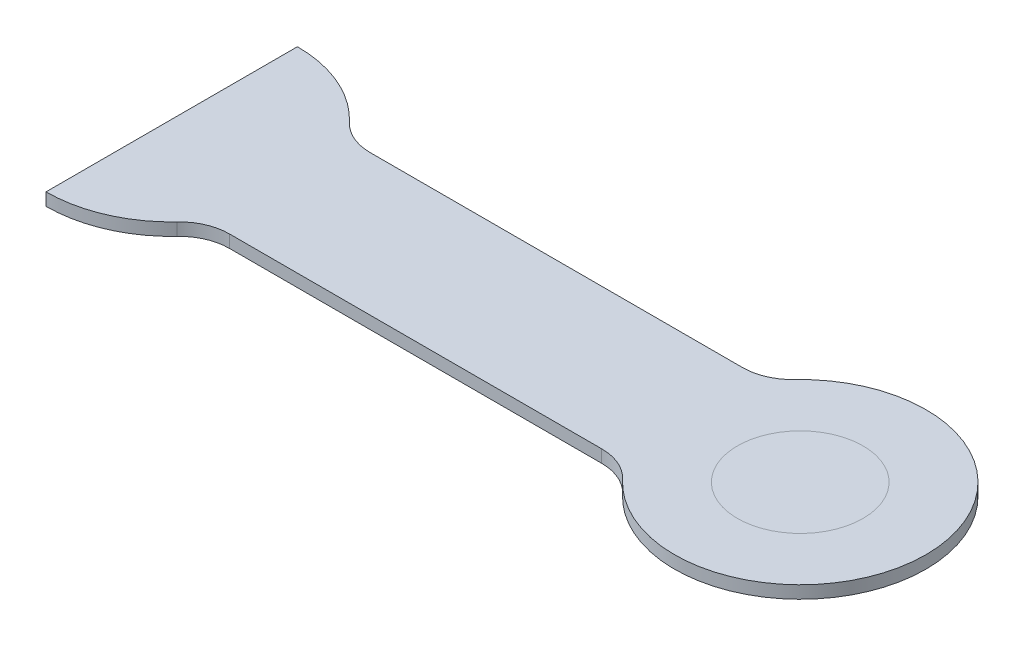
SolidWorks part; units mm, degrees
ref_plane "plane 1" through (0, 0, 0) normal (0, 0, 1) x (1, 0, 0)
ref_plane "plane 2" through (0, 0, 0) normal (0, 1, 0) x (1, 0, 0)
ref_plane "plane 3" through (0, 0, 0) normal (1, 0, 0) x (0, 0, -1)
sketch "Sketch1" plane through (0, 0, 0) normal (0, 0, 1) x (1, 0, 0)
  line L0 (0, 0) -> (-300, 0)
  dimension "D1" = 300
extrude "Base-Extrude-Thin" add sketch "Sketch1" along normal mid plane 100 thin
sketch "Sketch2" plane through (0, 5, 0) normal (0, 1, 0) x (-1, 0, 0)
  line L0 (0, 0) -> (316.1757, 0) construction
  line L1 (91.4246, 28) -> (258.5754, 28)
  line L2 (91.4246, -28) -> (258.5754, -28)
  line L3 (300, 50) -> (300, -50) construction
  line L5 (0, 50) -> (0, -50) construction
  line L6 (0, -50) -> (300, -50) construction
  line L7 (0, 50) -> (300, 50) construction
  line L8 (0, 50) -> (300, 50) construction
  line L9 (0, -50) -> (300, -50) construction
  arc A0 (91.4246, 28) -> (91.4246, -28) centre (50, 0) ccw
  arc A1 (300, 50) -> (258.5754, 28) centre (300, 0) ccw
  arc A2 (258.5754, -28) -> (300, -50) centre (300, 0) ccw
  dimension "D1" = 56
  dimension "D2" = 28
extrude "Cut-Extrude2" cut sketch "Sketch2" against normal through all flip side to cut
fillet "Fillet1" radius 20 4 edges at (-258.5754, 2.5, -28) (-258.5754, 2.5, 28) (-91.4246, 2.5, 28) (-91.4246, 2.5, -28)
sketch "Sketch5" plane through (0, 5, 0) normal (0, 1, 0) x (1, 0, 0)
  circle A0 centre (-50, 0) radius 25
  arc A1 (-86.3935, -34.2857) -> (-86.3935, 34.2857) centre (-50, 0) ccw construction
  dimension "D1" = 50
